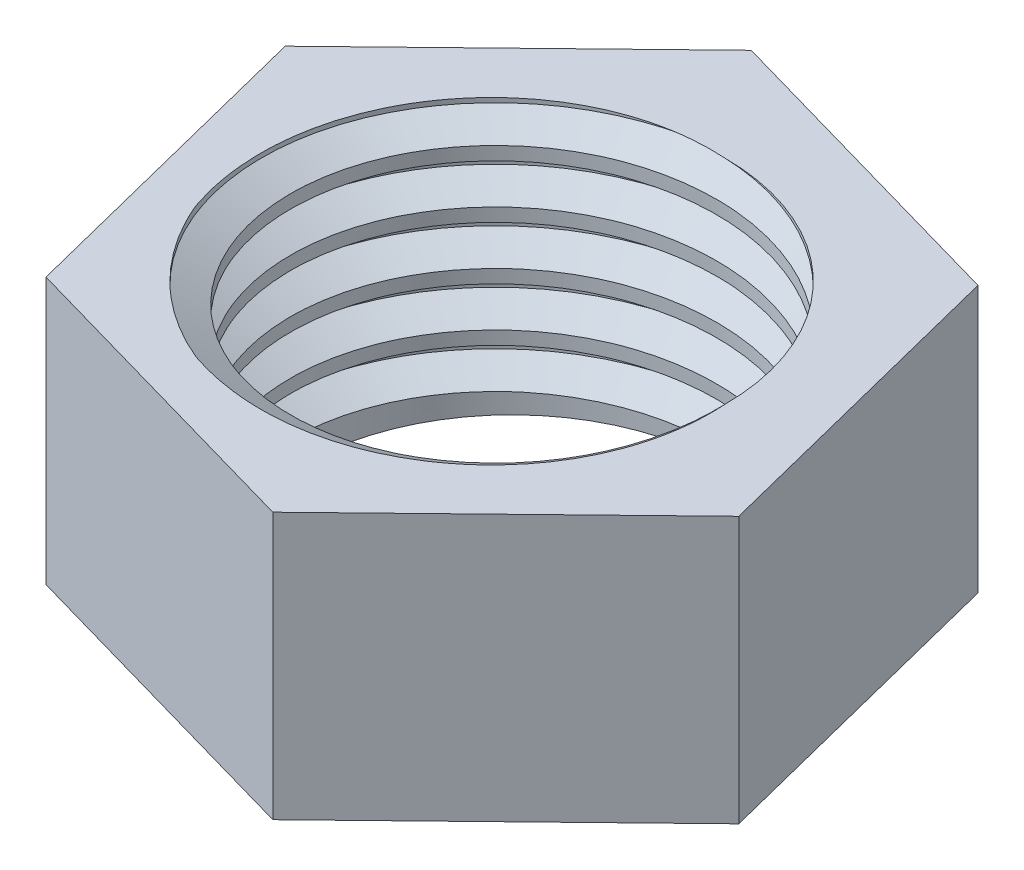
SolidWorks part; units mm, degrees
ref_plane "Front Plane" through (0, 0, 0) normal (0, 0, 1) x (1, 0, 0)
ref_plane "Top Plane" through (0, 0, 0) normal (0, 1, 0) x (1, 0, 0)
ref_plane "Right Plane" through (0, 0, 0) normal (1, 0, 0) x (0, 0, -1)
sketch "Sketch2" plane through (0, 0, 0) normal (0, 1, 0) x (1, 0, 0)
  line L1 (5.9508, -1.6929) -> (4.4415, 4.3071)
  line L2 (4.4415, 4.3071) -> (-1.5093, 6)
  line L3 (-1.5093, 6) -> (-5.9508, 1.6929)
  line L4 (-5.9508, 1.6929) -> (-4.4415, -4.3071)
  line L5 (-4.4415, -4.3071) -> (1.5093, -6)
  line L6 (1.5093, -6) -> (5.9508, -1.6929)
  circle A0 centre (0, 0) radius 5.358 construction
  dimension "D1" = 12
extrude "Boss-Extrude1" add sketch "Sketch2" along normal blind 5
sketch "Sketch3" plane through (0, 0, 0) normal (0, -1, 0) x (1, 0, 0)
  line L0 (-4.4415, 4.3071) -> (4.4415, -4.3071) construction
  circle A0 centre (0, 0) radius 4
  dimension "D1" = 8
extrude "Cut-Extrude1" cut sketch "Sketch3" against normal blind 5
sketch "Sketch6" plane through (-5.1962, 0, 1.3071) normal (-0.9698, 0, 0.244) x (0.244, 0, 0.9698)
  line L5 (7.0759, 6.9731) -> (7.0859, 6.9731)
  line L6 (7.0759, 6.9731) -> (7.0759, 6.8986)
  line L7 (7.0759, 6.8986) -> (7.0859, 6.8986)
  line L8 (7.0859, 6.9731) -> (7.0859, 6.8986)
thread "Thread2" pitch 1 start angle 0, offset 0, length 0, pitch 1, diameter 8
ref_plane "Plane5" through (4, 0, 0) normal (0, 0, 1) x (1, 0, 0)
sketch "Thread Profile5" plane through (4, 0, 0) normal (0, 0, 1) x (1, 0, 0)
  line L0 (0, 0) -> (0, 1) construction
  line L1 (0, 0) -> (0.5413, 0.3125)
  line L2 (0.5413, 0.3125) -> (0.5413, 0.4375)
  line L3 (0.5413, 0.4375) -> (0, 0.75)
  line L4 (0.5413, 0.375) -> (0, 0.375) construction
  line L11 (0, 0) -> (0, 0.75)
  point P2 (0, 0)
  dimension "Pitch" = 1
  dimension "Profile_Angle" = 60
  dimension "Profile_Land" = 0.125
  dimension "Profile_Height" = 0.5413
